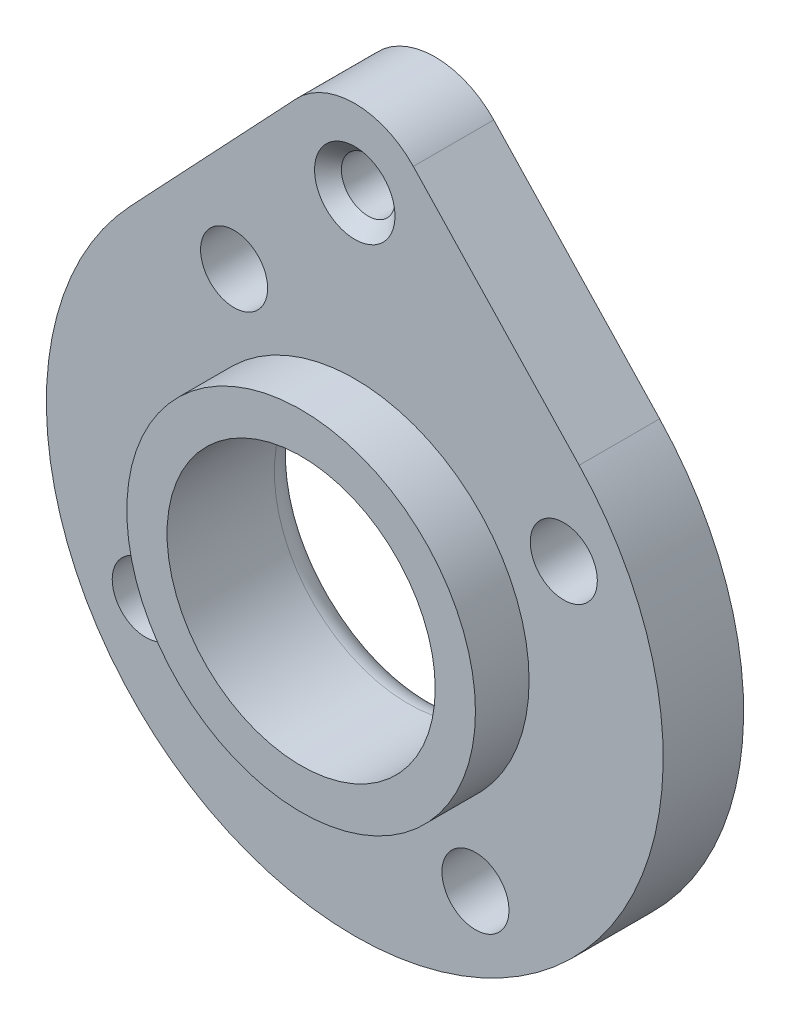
SolidWorks part; units mm, degrees
ref_plane "前视基准面" through (0, 0, 0) normal (0, 0, 1) x (1, 0, 0)
ref_plane "上视基准面" through (0, 0, 0) normal (0, 1, 0) x (1, 0, 0)
ref_plane "右视基准面" through (0, 0, 0) normal (1, 0, 0) x (0, 0, -1)
sketch "草图1" plane through (0, 0, 0) normal (0, 0, 1) x (1, 0, 0)
  line L0 (4.3654, 28.8963) -> (16.7341, 15.7788)
  line L1 (0, 0) -> (0, 36.0416) construction
  line L2 (0, 36.0416) -> (0, 0) construction
  line L3 (0, 0) -> (39.9899, 0) construction
  line L4 (-4.3654, 28.8963) -> (-16.7341, 15.7788)
  line L5 (-9, 15.5885) -> (0, 0) construction
  line L7 (0, 0) -> (16.8831, 9.7474) construction
  arc A0 (-16.7341, 15.7788) -> (16.7341, 15.7788) centre (0, 0) ccw
  arc A1 (4.3654, 28.8963) -> (-4.3654, 28.8963) centre (0, 24.7801) ccw
  circle A2 centre (9, -15.5885) radius 2.5
  circle A3 centre (-9, 15.5885) radius 2.5
  circle A4 centre (15.5885, 9) radius 2.5
  circle A5 centre (-15.5885, -9) radius 2.5
  circle A6 centre (0, 0) radius 10
  dimension "D1" = 18
  dimension "D2" = 5
  dimension "D3" = 18
extrude "拉伸1" add sketch "草图1" along normal blind 6
sketch "草图2" plane through (0, 0, 6) normal (0, 0, 1) x (1, 0, 0)
  circle A0 centre (0, 0) radius 13
  circle A1 centre (0, 0) radius 10
extrude "拉伸2" add sketch "草图2" along normal blind 4
sketch "草图4" plane through (0, 0, 0) normal (1, 0, 0) x (0, 0, -1)
  line L0 (-13.5715, 25) -> (10.0749, 25) construction
  line L1 (-6, 28) -> (-5, 27)
  line L2 (-6, 15.7788) -> (-6, 28.8963) construction
  line L3 (-5, 27) -> (0, 27)
  line L4 (0, 15.7788) -> (0, 28.8963) construction
  line L5 (0, 27) -> (0, 25)
  line L6 (0, 25) -> (-6, 25)
  line L7 (-6, 25) -> (-6, 28)
  dimension "D1" = 25
revolve "切除-旋转1" cut sketch "草图4" angle 360 about L6
fillet "圆角1" radius 2 1 edges at (10, 0, 0)
